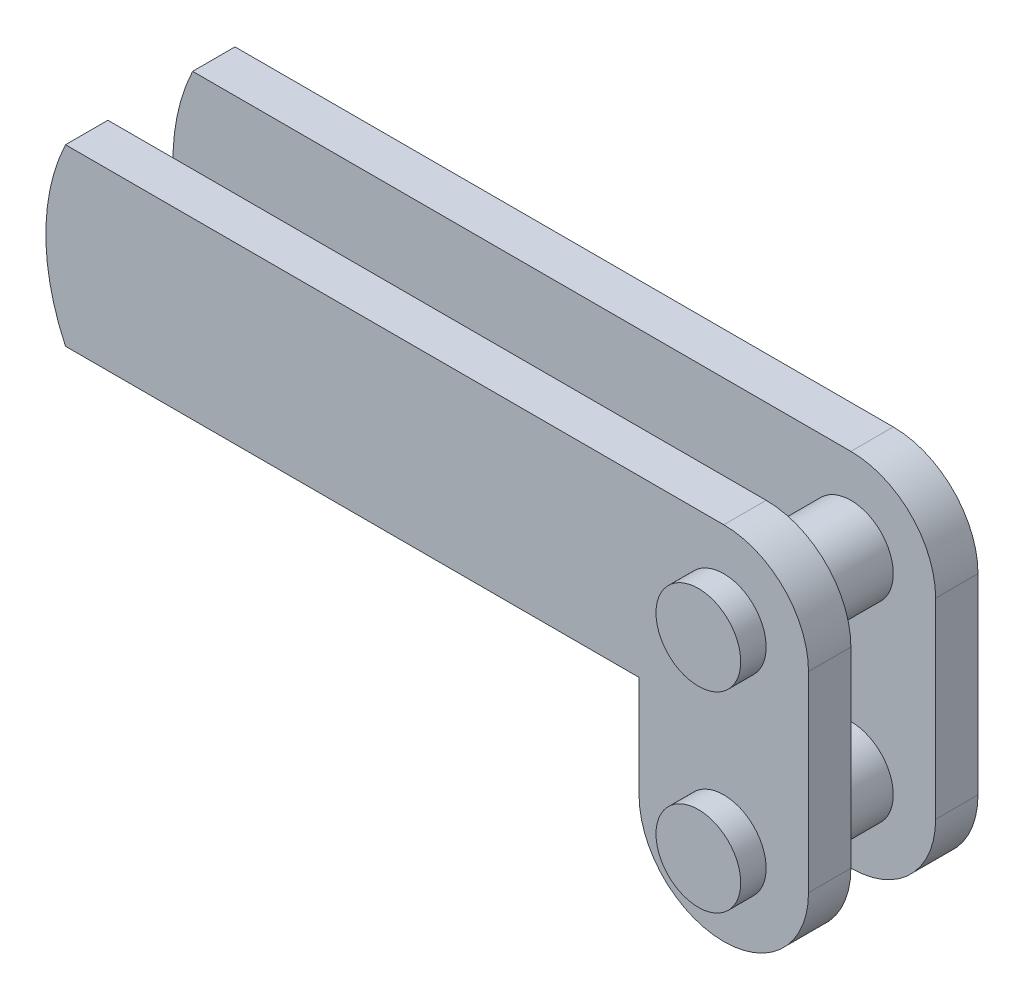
SolidWorks part; units mm, degrees
ref_plane "Ebene1" through (0, 0, 0) normal (0, 0, 1) x (1, 0, 0)
ref_plane "Ebene2" through (0, 0, 0) normal (0, 1, 0) x (1, 0, 0)
ref_plane "Ebene3" through (0, 0, 0) normal (1, 0, 0) x (0, 0, -1)
sketch "Skizze1" plane through (0, 0, 0) normal (0, 0, 1) x (1, 0, 0)
  line L0 (-43.8387, 0) -> (0, 0)
  line L1 (0, 0) -> (0, -21.3)
  line L2 (0, -21.3) -> (-10, -21.3)
  line L3 (-10, -21.3) -> (-10, -10.3)
  line L4 (-10, -10.3) -> (-43.8387, -10.3)
  arc A0 (-43.8387, 0) -> (-43.8387, -10.3) centre (-33, -5.15) ccw
  dimension "D5" = 12
  dimension "D1" = 5.15
  dimension "D2" = 10
  dimension "D3" = 21.3
  dimension "D4" = 45
  dimension "D6" = 10.3
extrude "Basis-Linear austragen" add sketch "Skizze1" along normal mid plane 10
fillet "Verrundung1" radius 5
sketch "Skizze2" plane through (0, 0, 0) normal (0, 0, 1) x (1, 0, 0)
  line L4 (0, -16.3) -> (0, -5)
  line L5 (-5, 0) -> (-43.8387, 0)
  line L6 (-43.8387, -10.3) -> (-10, -10.3)
  line L7 (-10, -10.3) -> (-10, -16.3)
  line L8 (0, -16.3) -> (0, -5)
  line L9 (-5, 0) -> (-43.8387, 0)
  line L10 (-43.8387, -10.3) -> (-10, -10.3)
  line L11 (-10, -10.3) -> (-10, -16.3)
  circle A0 centre (-5, -5) radius 2.5
  circle A1 centre (-5, -16.3) radius 2.5
  arc A4 (0, -5) -> (-5, 0) centre (-5, -5) ccw
  arc A5 (-43.8387, 0) -> (-43.8387, -10.3) centre (-33, -5.15) ccw
  arc A6 (-10, -16.3) -> (-5, -21.3) centre (-5, -16.3) ccw
  arc A7 (-5, -21.3) -> (0, -16.3) centre (-5, -16.3) ccw
  arc A8 (0, -5) -> (-5, 0) centre (-5, -5) ccw
  arc A9 (-43.8387, 0) -> (-43.8387, -10.3) centre (-33, -5.15) ccw
  arc A10 (-10, -16.3) -> (-5, -21.3) centre (-5, -16.3) ccw
  arc A11 (-5, -21.3) -> (0, -16.3) centre (-5, -16.3) ccw
  dimension "D2" = 5
  dimension "D3" = 5
  dimension "D1" = 0
extrude "Schnitt-Linear austragen1" cut sketch "Skizze2" against normal mid plane 5
sketch "Skizze3" plane through (0, 0, 0) normal (0, 0, 1) x (1, 0, 0)
  circle A0 centre (-5, -16.3) radius 2.5 construction
  circle A1 centre (-5, -5) radius 2.5 construction
  circle A2 centre (-5, -16.3) radius 2.5
  circle A3 centre (-5, -5) radius 2.5
extrude "Aufsatz-Linear austragen1" add sketch "Skizze3" along normal mid plane 13
